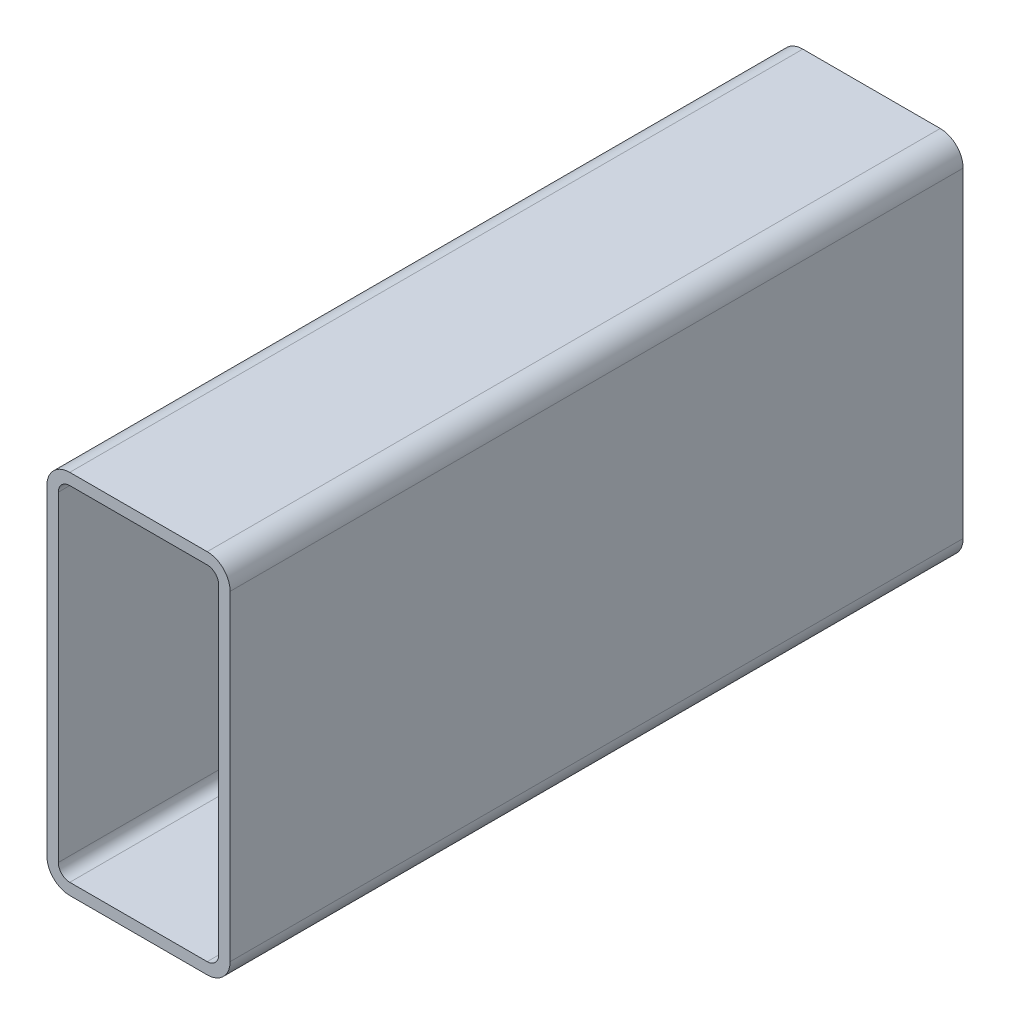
SolidWorks part; units mm, degrees
ref_plane "Front Plane" through (0, 0, 0) normal (0, 0, 1) x (1, 0, 0)
ref_plane "Top Plane" through (0, 0, 0) normal (0, 1, 0) x (1, 0, 0)
ref_plane "Right Plane" through (0, 0, 0) normal (1, 0, 0) x (0, 0, -1)
sketch "Sketch1" plane through (0, 0, 0) normal (0, 0, 1) x (1, 0, 0)
sketch_block_instance "HSS6x3x0.1875-1"
sketch_block "HSS6x3x0.1875"
extrude "Boss-Extrude1" add sketch "Sketch1" along normal blind 304.8
